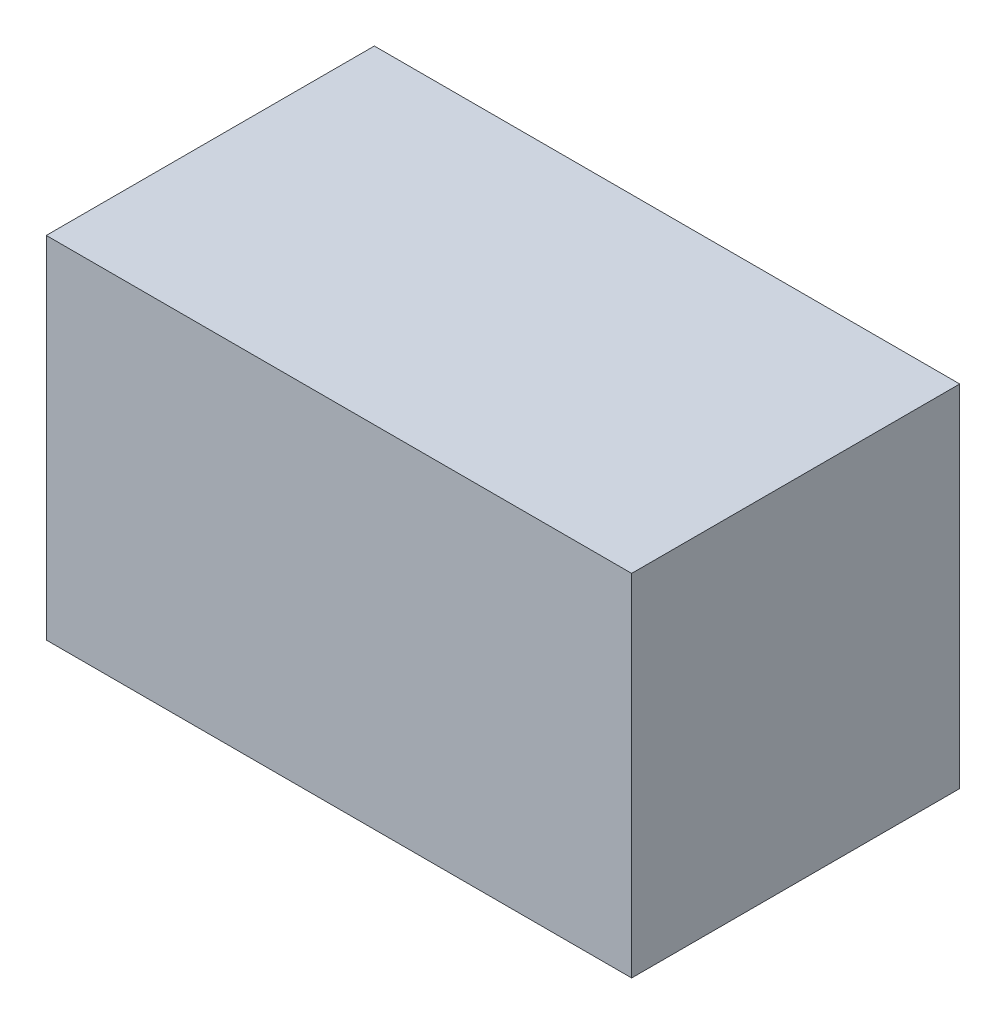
SolidWorks part; units mm, degrees
ref_plane "Front Plane"
ref_plane "Top Plane" through (0, 0, 0) normal (0, 1, 0) x (1, 0, 0)
ref_plane "Right Plane" through (0, 0, 0) normal (1, 0, 0) x (0, 0, -1)
sketch "Sketch2" plane through (0, 0, 0) normal (0, 1, 0) x (1, 0, 0)
  line L1 (-109.6868, 61.4728) -> (109.6868, 61.4728)
  line L2 (-109.6868, 61.4728) -> (-109.6868, -61.4728)
  line L3 (-109.6868, -61.4728) -> (109.6868, -61.4728)
  line L4 (109.6868, 61.4728) -> (109.6868, -61.4728)
  line L5 (-109.6868, 61.4728) -> (109.6868, -61.4728) construction
  line L6 (-109.6868, -61.4728) -> (109.6868, 61.4728) construction
  point P0 (0, 0)
extrude "Boss-Extrude1" add sketch "Sketch2" along normal blind 131.318
shell "Shell1" thickness 2.54
